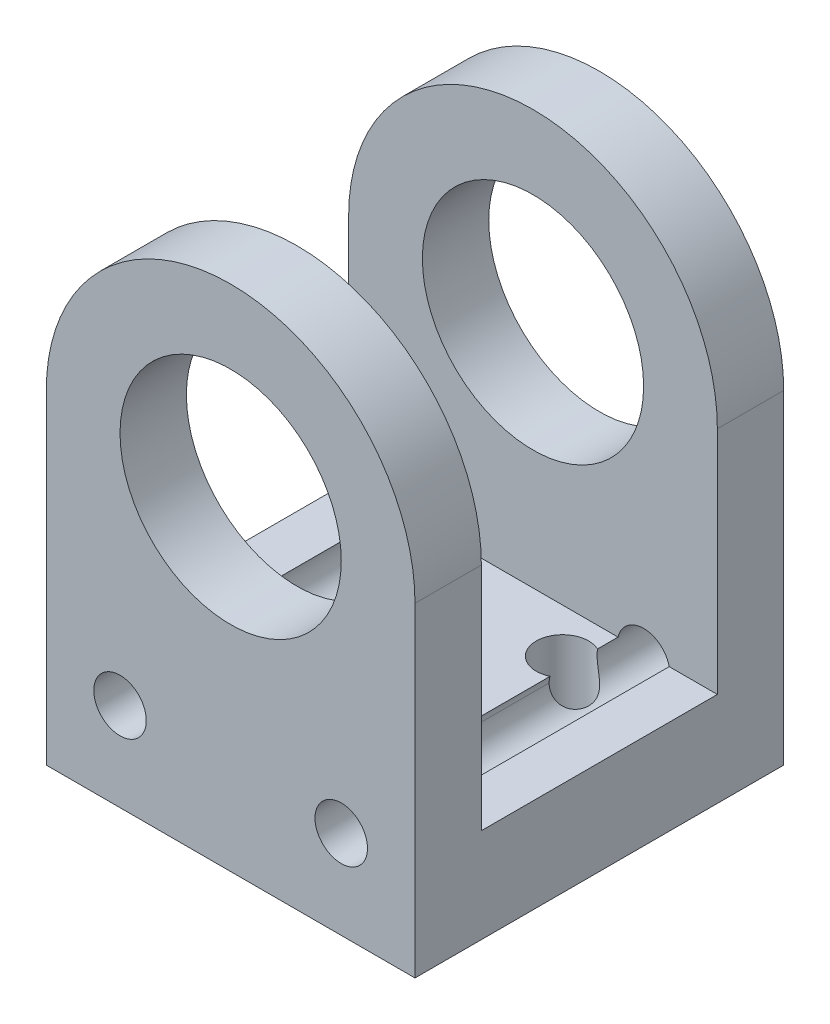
SolidWorks part; units mm, degrees
ref_plane "Front" through (0, 0, 0) normal (0, 0, 1) x (1, 0, 0)
ref_plane "Top" through (0, 0, 0) normal (0, 1, 0) x (1, 0, 0)
ref_plane "Right" through (0, 0, 0) normal (1, 0, 0) x (0, 0, -1)
sketch "Sketch1" plane through (0, 0, 0) normal (0, 0, 1) x (1, 0, 0)
  line L0 (7.9375, 0) -> (-7.9375, 0)
  line L1 (-7.9375, 0) -> (-7.9375, 13.97)
  line L5 (0, 0) -> (0, 13.97) construction
  line L8 (7.9375, 0) -> (7.9375, 13.97)
  circle A0 centre (0, 13.97) radius 4.7625
  arc A1 (7.9375, 13.97) -> (-7.9375, 13.97) centre (0, 13.97) ccw
  dimension "D5" = 9.525
  dimension "D1" = 13.97
  dimension "D2" = 15.875
extrude "Extrude1" add sketch "Sketch1" along normal mid plane 15.875
sketch "Sketch2" plane through (7.9375, 0, 0) normal (1, 0, 0) x (0, 0, -1)
  line L0 (0, 0) -> (0, 21.5049) construction
  line L1 (-5.08, 4.064) -> (5.08, 4.064)
  line L2 (-5.08, 4.064) -> (-5.08, 38.7599)
  line L3 (-5.08, 38.7599) -> (5.08, 38.7599)
  line L4 (5.08, 4.064) -> (5.08, 38.7599)
  dimension "D1" = 4.064
  dimension "D2" = 10.16
extrude "Cut-Extrude1" cut sketch "Sketch2" against normal through all
hole_wizard "#4-40 Tapped Hole2" positions "Sketch4" profile "Sketch3" tap size "#4-40" standard "Ansi Inch"
sketch "Sketch4" plane through (0, 0, 0) normal (0, -1, 0) x (1, 0, 0)
  line L0 (0, 0) -> (-10.7337, 0) construction
  line L1 (-10.7337, 0) -> (0, 11.1943) construction
  line L2 (0, 11.1943) -> (0, 0) construction
  point P0 (-3.175, -3.175)
  point P12 (-3.175, 3.175)
  point P14 (3.175, -3.175)
  point P15 (3.175, 3.175)
  dimension "D1" = 6.35
  dimension "D2" = 6.35
sketch "Sketch3" plane through (-3.175, 0, -3.175) normal (1, 0, 0) x (0, 0, -1)
  line L0 (0, 0) -> (0, 21.9075)
  line L1 (0, 21.9075) -> (1.1303, 21.9075)
  line L2 (1.1303, 21.9075) -> (1.1303, 0)
  line L5 (1.1303, 0) -> (0, 0)
  line L11 (0, -6.35) -> (0, 107.95) construction
  dimension "Thru Tap Drill Dia." = 2.2606
  dimension "Thru Tap Drill Depth" = 21.9075
hole_wizard "#4-40 Tapped Hole1" positions "Sketch6" profile "Sketch5" tap size "#4-40" standard "Ansi Inch"
sketch "Sketch6" plane through (0, 0, -7.9375) normal (0, 0, -1) x (-1, 0, 0)
  line L0 (0, 0) -> (0, 13.97) construction
  line L2 (7.9375, 0) -> (-7.9375, 0) construction
  point P0 (4.7625, 3.81)
  point P8 (-4.7625, 3.81)
  dimension "D1" = 9.525
  dimension "D2" = 3.81
sketch "Sketch5" plane through (-4.7625, 3.81, -7.9375) normal (1, 0, 0) x (0, 1, 0)
  line L0 (0, 0) -> (0, 15.875)
  line L1 (0, 15.875) -> (1.1303, 15.875)
  line L2 (1.1303, 15.875) -> (1.1303, 0)
  line L5 (1.1303, 0) -> (0, 0)
  line L11 (0, -6.35) -> (0, 107.95) construction
  dimension "Thru Tap Drill Dia." = 2.2606
  dimension "Thru Tap Drill Depth" = 15.875
